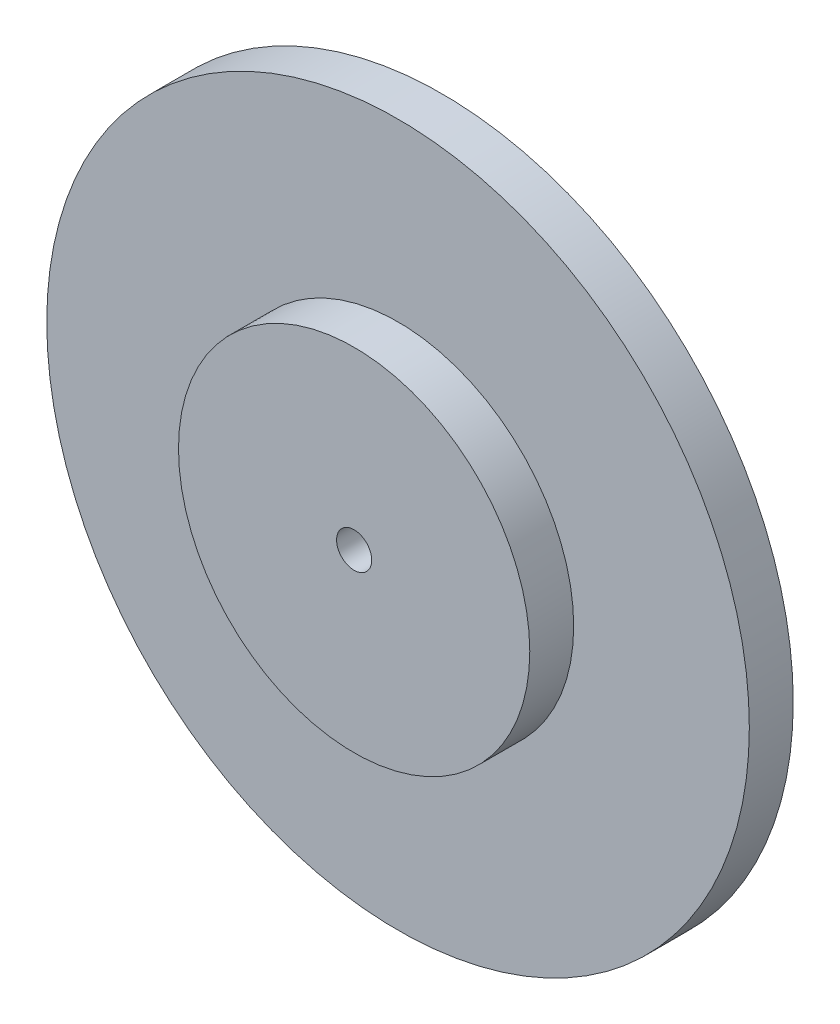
SolidWorks part; units mm, degrees
ref_plane "Front Plane" through (0, 0, 0) normal (0, 0, 1) x (1, 0, 0)
ref_plane "Top Plane" through (0, 0, 0) normal (0, 1, 0) x (1, 0, 0)
ref_plane "Right Plane" through (0, 0, 0) normal (1, 0, 0) x (0, 0, -1)
sketch "Sketch1" plane through (0, 0, 0) normal (0, 0, 1) x (1, 0, 0)
  circle A0 centre (0, 0) radius 50.8
extrude "Boss-Extrude1" add sketch "Sketch1" along normal blind 6.35
sketch "Sketch2" plane through (0, 0, 6.35) normal (0, 0, 1) x (1, 0, 0)
  circle A0 centre (0, 0) radius 25.4
extrude "Boss-Extrude2" add sketch "Sketch2" along normal blind 6.35
sketch "Sketch3" plane through (0, 0, 12.7) normal (0, 0, 1) x (1, 0, 0)
  circle A0 centre (0, 0) radius 2.54
extrude "Cut-Extrude1" cut sketch "Sketch3" against normal through all
